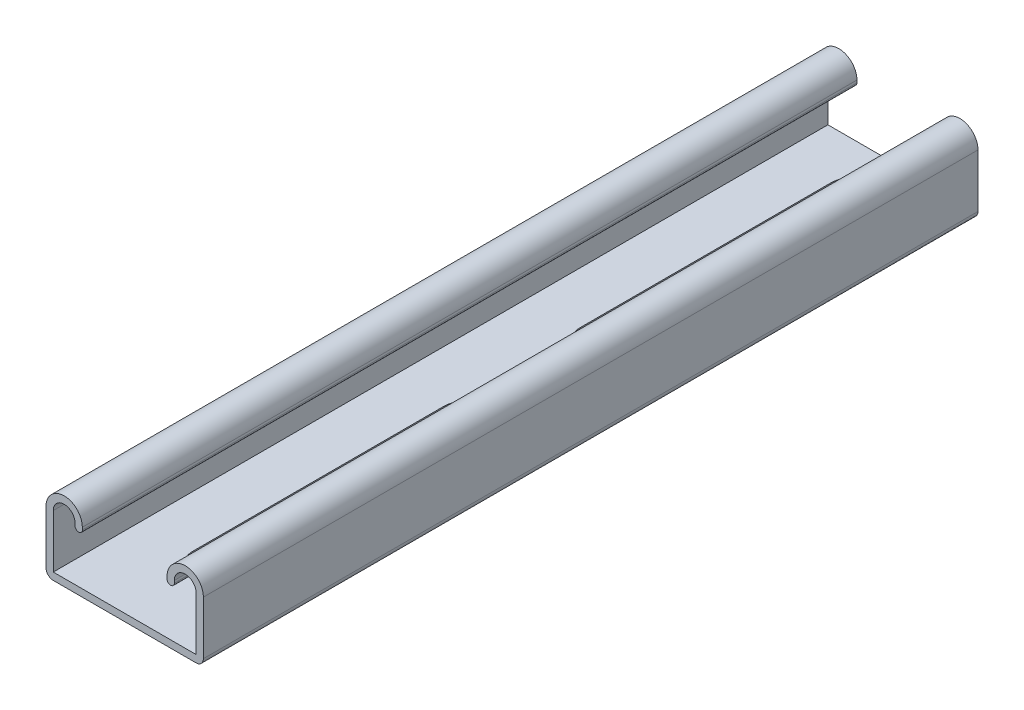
SolidWorks part; units mm, degrees
ref_plane "Plane1" through (0, 0, 0) normal (0, 0, 1) x (1, 0, 0)
ref_plane "Plane2" through (0, 0, 0) normal (0, 1, 0) x (1, 0, 0)
ref_plane "Plane3" through (0, 0, 0) normal (1, 0, 0) x (0, 0, -1)
sketch "Sketch1" plane through (0, 0, 0) normal (0, 0, 1) x (1, 0, 0)
  line L0 (-20.6375, 7.4295) -> (-20.6375, -6.5532)
  line L1 (-18.7325, -8.4582) -> (18.7325, -8.4582)
  line L2 (20.6375, -6.5532) -> (20.6375, 7.4295)
  line L3 (11.1125, 7.4295) -> (11.1125, 6.7945)
  line L4 (-11.1125, 7.4295) -> (-11.1125, 6.7945)
  line L5 (-13.0175, 7.4295) -> (-13.0175, 6.7945)
  line L6 (-18.7325, 7.4295) -> (-18.7325, -6.5532)
  line L7 (-18.7325, -6.5532) -> (18.7325, -6.5532)
  line L8 (18.7325, -6.5532) -> (18.7325, 7.4295)
  line L9 (13.0175, 7.4295) -> (13.0175, 6.7945)
  line L10 (-25.4, 12.192) -> (25.4, 12.192) construction
  line L11 (-12.8524, 5.842) -> (12.8524, 5.842) construction
  arc A0 (20.6375, 7.4295) -> (11.1125, 7.4295) centre (15.875, 7.4295) ccw
  arc A1 (-20.6375, 7.4295) -> (-11.1125, 7.4295) centre (-15.875, 7.4295) cw
  arc A2 (-18.7325, -8.4582) -> (-20.6375, -6.5532) centre (-18.7325, -6.5532) cw
  arc A3 (18.7325, -8.4582) -> (20.6375, -6.5532) centre (18.7325, -6.5532) ccw
  arc A4 (-18.7325, 7.4295) -> (-13.0175, 7.4295) centre (-15.875, 7.4295) cw
  arc A5 (18.7325, 7.4295) -> (13.0175, 7.4295) centre (15.875, 7.4295) ccw
  arc A6 (11.1125, 6.7945) -> (13.0175, 6.7945) centre (12.065, 6.7945) ccw
  arc A7 (-11.1125, 6.7945) -> (-13.0175, 6.7945) centre (-12.065, 6.7945) cw
  dimension "D1" = 1.905
  dimension "D3" = 20.6375
  dimension "Width" = 41.275
  dimension "D5" = 8.4582
  dimension "D6" = 9.525
  dimension "D7" = 22.225
  dimension "D8" = 12.192
  dimension "D9" = 6.35
  dimension "gauge" = 1.905
extrude "Base-Extrude" add sketch "Sketch1" along normal blind 203.2
extrude "Slot" cut sketch "Sketch2" against normal through all
sketch "Sketch2" plane through (-0.5607, -8.4582, -8.3136) normal (0, -1, 0) x (1, 0, 0)
  line L0 (5.7201, 86.8949) -> (5.7201, 21.0136)
  line L1 (-4.5987, 21.0136) -> (-4.5987, 86.8949)
  arc A0 (-4.5987, 21.0136) -> (5.7201, 21.0136) centre (0.5607, 21.0136) ccw
  arc A1 (5.7201, 86.8949) -> (-4.5987, 86.8949) centre (0.5607, 86.8949) ccw
  dimension "D3" = 10.3187
  dimension "D1" = 12.7
  dimension "D2" = 65.8813
pattern_linear "LPattern1" count 2 spacing 101.6 along (0, 0, 1) of "Slot"
equation "\"D3@Sketch1\" = \"Width@Sketch1\" / 2"
equation "\"D7@Sketch1\" = \"Width@Sketch1\" - 2 * \"D6@Sketch1\""
equation "\"D1@Sketch1\" = \"gauge@Sketch1\""
equation "\"D1@LPattern1\" = \"D1@Base-Extrude\" / \"D3@LPattern1\""
